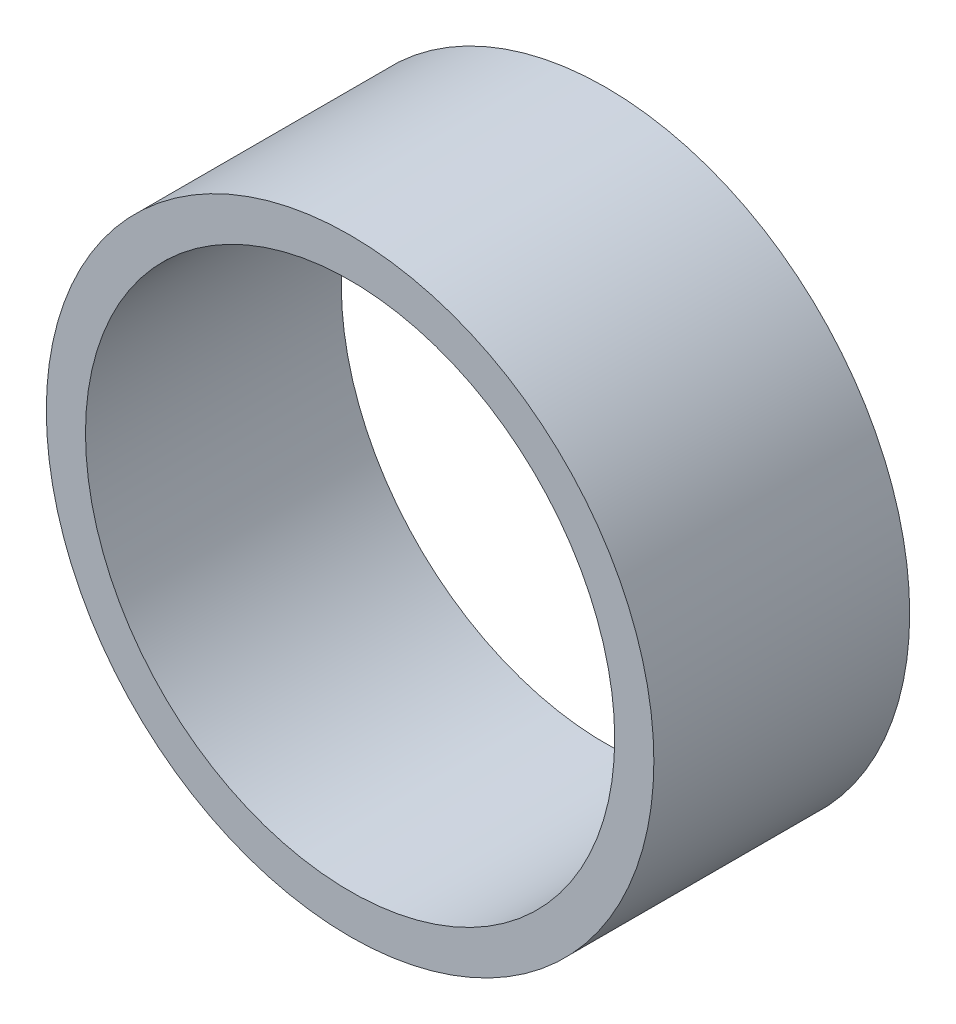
SolidWorks part; units mm, degrees
ref_plane "Front Plane" through (0, 0, 0) normal (1, 0, 0) x (0, 1, 0)
ref_plane "Top Plane" through (0, 0, 0) normal (0, 0, 1) x (0, 1, 0)
ref_plane "Right Plane" through (0, 0, 0) normal (0, 1, 0) x (-1, 0, 0)
sketch "Sketch1" plane through (0, 0, 0) normal (0, 0, 1) x (0, 1, 0)
  line L0 (0, -7.7) -> (0, 7.7) construction
  circle A0 centre (0, 0) radius 7.7 construction
  arc A1 (2.6325, 0) -> (-2.6325, 0) centre (0, 3.4) ccw
  arc A2 (-2.6325, 0) -> (2.6325, 0) centre (0, -3.4) ccw
  circle A3 centre (0, 0) radius 9.5
  dimension "D1" = 15.4
  dimension "D2" = 8.6
  dimension "D3" = 8.6
  dimension "D4" = 19
sketch "Sketch2" plane through (0, 0, 0) normal (0, 0, 1) x (0, 1, 0)
  circle A0 centre (0, 0) radius 8.275
  circle A1 centre (0, 0) radius 9.5
  dimension "D1" = 16.55
  dimension "D2" = 19
extrude "Boss-Extrude2" add sketch "Sketch2" against normal blind 8
